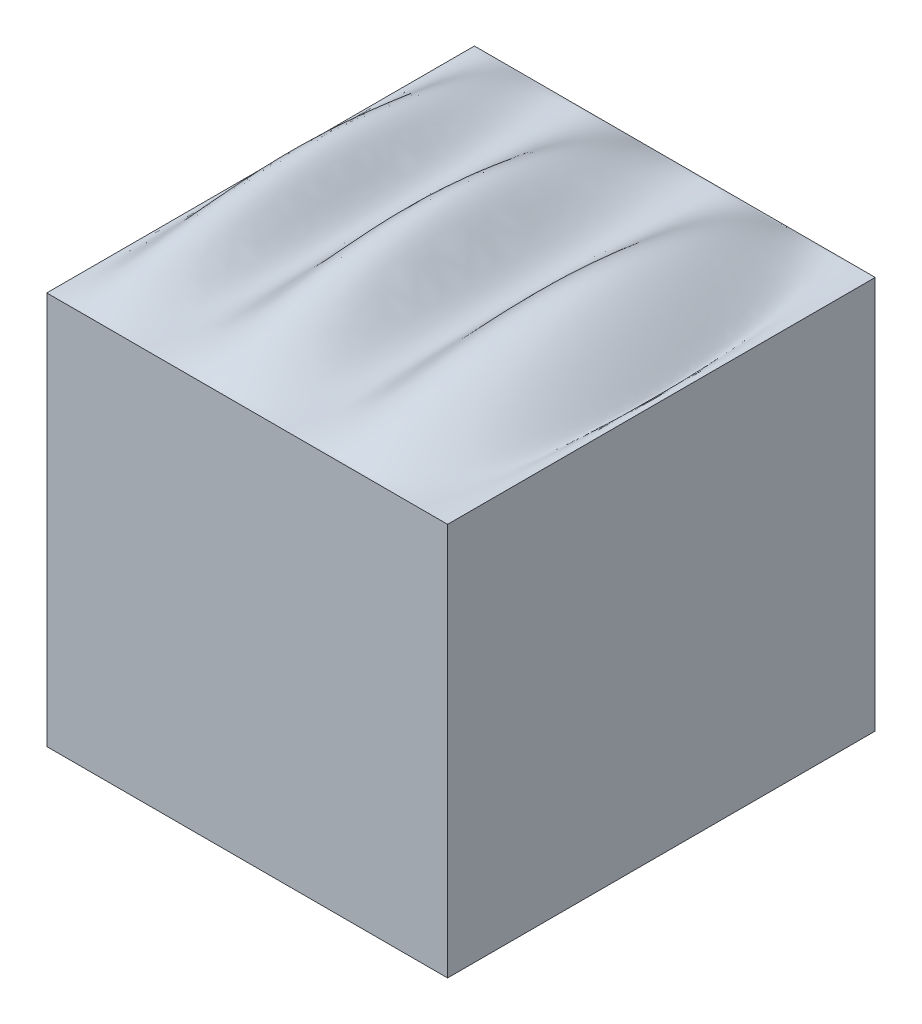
SolidWorks part; units mm, degrees
ref_plane "Front Plane" through (0, 0, 0) normal (0, 0, 1) x (1, 0, 0)
ref_plane "Top Plane" through (0, 0, 0) normal (0, 1, 0) x (1, 0, 0)
ref_plane "Right Plane" through (0, 0, 0) normal (1, 0, 0) x (0, 0, -1)
sketch "Sketch1" plane through (0, 0, 0) normal (0, 0, 1) x (1, 0, 0)
  line L1 (-27.377, -26.8357) -> (27.377, -26.8357)
  line L2 (-27.377, -26.8357) -> (-27.377, 26.8357)
  line L3 (-27.377, 26.8357) -> (27.377, 26.8357)
  line L4 (27.377, -26.8357) -> (27.377, 26.8357)
  line L5 (-27.377, -26.8357) -> (27.377, 26.8357) construction
  line L6 (-27.377, 26.8357) -> (27.377, -26.8357) construction
  point P0 (0, 0)
extrude "Boss-Extrude1" add sketch "Sketch1" along normal mid plane 58.42
sketch "Sketch2" plane through (0, 0, 0) normal (0, 0, 1) x (1, 0, 0)
  line L0 (27.377, 26.8357) -> (-27.377, 26.8357) construction
  spline S0 degree 3 poles (-27.377, 26.8357) (-24.1358, 38.531) (-15.3429, 18.3782) (-5.1359, 39.6514) (8.7754, 15.5041) (18.3693, 44.6055) (24.9378, 26.8357) knots 0 0 0 0 0.25812 0.434181 0.634633 1 1 1 1
other "Freeform1"
